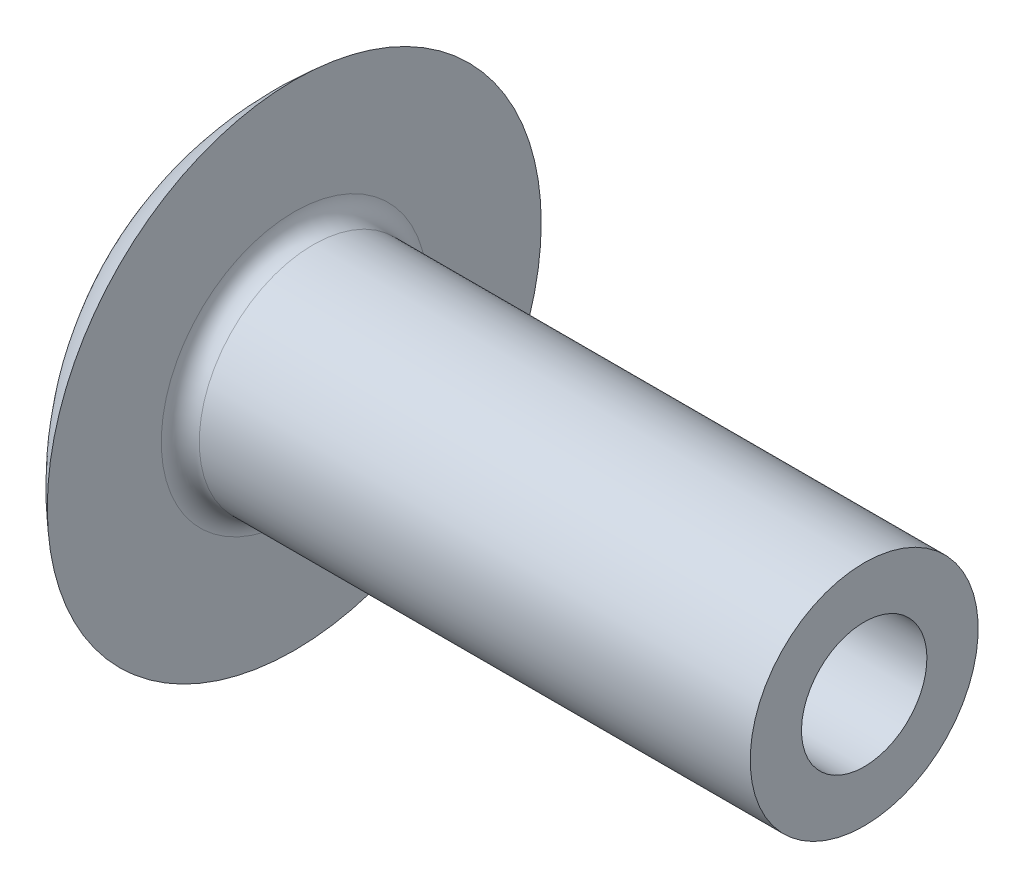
SolidWorks part; units mm, degrees
ref_plane "Front" through (0, 0, 0) normal (0, 0, 1) x (1, 0, 0)
ref_plane "Top" through (0, 0, 0) normal (0, 1, 0) x (1, 0, 0)
ref_plane "Right" through (0, 0, 0) normal (1, 0, 0) x (0, 0, -1)
other "Configuration Table"
sketch "Sketch1" plane through (4.2423, 2.9423, 0) normal (0, 0, 1) x (0, 1, 0)
  line L0 (-2.6123, 0.6423) -> (-2.3423, 0.6423)
  line L1 (-2.3423, 0.6423) -> (-2.3423, 3.6423)
  line L2 (-2.3423, 3.6423) -> (-1.6423, 3.6423)
  line L3 (-2.9423, 11.1005) -> (-2.9423, -2.6313) construction
  line L4 (-2.9423, 2.2728) -> (-2.9423, 4.2423)
  line L5 (-2.6123, 0.6423) -> (-2.6123, 2.0823)
  line L6 (-2.6123, 2.0823) -> (-2.9423, 2.2728)
  arc A0 (-1.6423, 3.6423) -> (-2.9423, 4.2423) centre (-2.9423, 2.534) ccw
  dimension "l" = 3
  dimension "d" = 1.2
  dimension "D2" = 60
  dimension "dk" = 2.6
  dimension "K" = 0.6
  dimension "dt" = 0.66
  dimension "t" = 1.44
revolve "Base-Revolve" add sketch "Sketch1" angle 360 about L3
fillet "Fillet1" radius 0.1 1 edges at (0.6, -0.6, 0)
